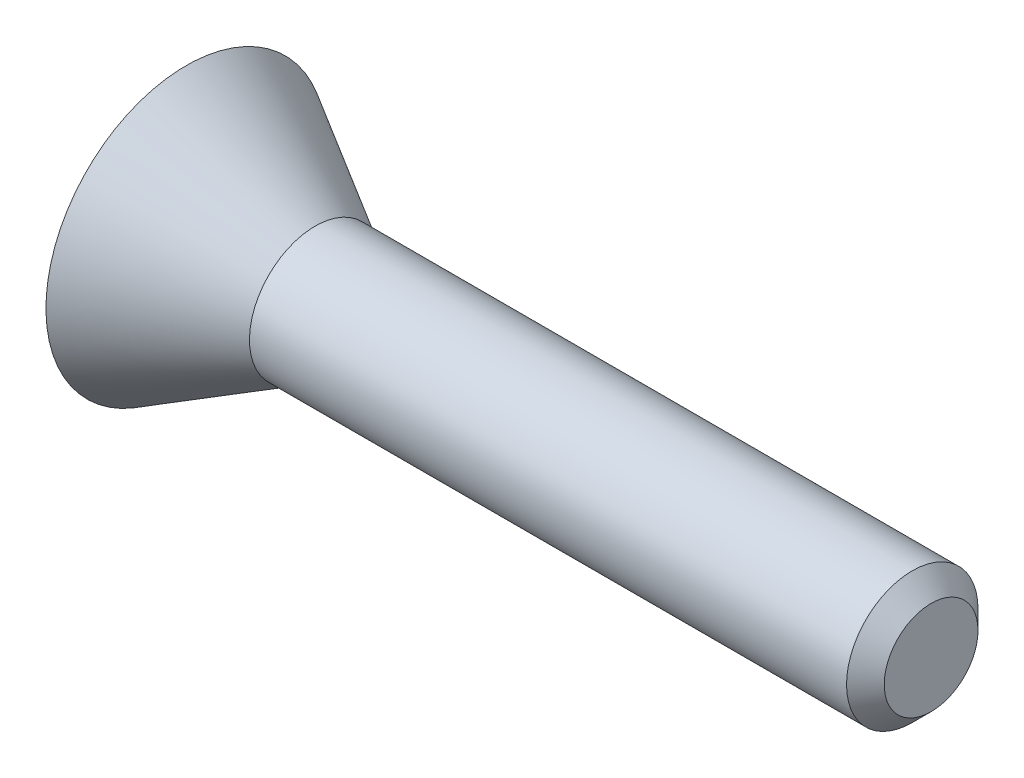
SolidWorks part; units mm, degrees
ref_plane "Front Plane" through (0, 0, 0) normal (0, 0, 1) x (1, 0, 0)
ref_plane "Top Plane" through (0, 0, 0) normal (0, 1, 0) x (1, 0, 0)
ref_plane "Right Plane" through (0, 0, 0) normal (1, 0, 0) x (0, 0, -1)
sketch "Sketch1" plane through (0, 0, 0) normal (1, 0, 0) x (0, 0, -1)
  circle A0 centre (0, 0) radius 3.2
  dimension "D1" = 6.4
extrude "Boss-Extrude1" add sketch "Sketch1" along normal mid plane 17 contours A0
sketch "Sketch2" plane through (0, 0, 0) normal (0, 0, 1) x (1, 0, 0)
  line L0 (-5.5555, 1.5) -> (8.5, 1.5)
  line L1 (8.5, -3.2) -> (8.5, 3.2) construction
  line L2 (8.5, 1.5) -> (8.5, 3.2)
  line L3 (-5.5555, 1.5) -> (-8.5, 3.2)
  line L4 (-8.5, 3.2) -> (8.5, 3.2)
  line L5 (-8.5, 3.2) -> (-8.5, -3.2) construction
  line L6 (-8.5, 0) -> (8.5, 0) construction
  dimension "D1" = 30
  dimension "D2" = 3
revolve "Cut-Revolve1" cut sketch "Sketch2" angle 360 about L6
sketch "Sketch3" plane through (-8.5, 0, 0) normal (-1, 0, 0) x (0, 0, 1)
  line L1 (0.32, 1.41) -> (0.32, -2.11)
  line L2 (0.77, 1.41) -> (0.32, 1.41)
  line L3 (0, 2.69) -> (0.77, 1.41)
  line L4 (0, 2.69) -> (-0.77, 1.41)
  line L5 (-0.77, 1.41) -> (-0.32, 1.41)
  line L6 (-0.32, 1.41) -> (-0.32, -2.11)
  line L7 (0, 3.2) -> (0, -3.2) construction
  arc A0 (-0.32, -2.11) -> (0.32, -2.11) centre (0, -2.11) ccw
  circle A1 centre (0, 0) radius 3.2 construction
  dimension "D6" = 0.64
  dimension "D2" = 0.77
  dimension "D3" = 1.54
  dimension "D1" = 0.51
  dimension "D5" = 1.28
extrude "Cut-Extrude1" cut sketch "Sketch3" against normal blind 0.6
chamfer "Chamfer1" distance 0.43 angle 45 1 edges at (8.5, -1.5, 0)
sketch "Sketch4" plane through (-8.5, 0, 0) normal (-1, 0, 0) x (0, 0, 1)
  text T0 "2  6" font "Bahnschrift" height 2.3
extrude "Cut-Extrude2" cut sketch "Sketch4" against normal blind 0.6
